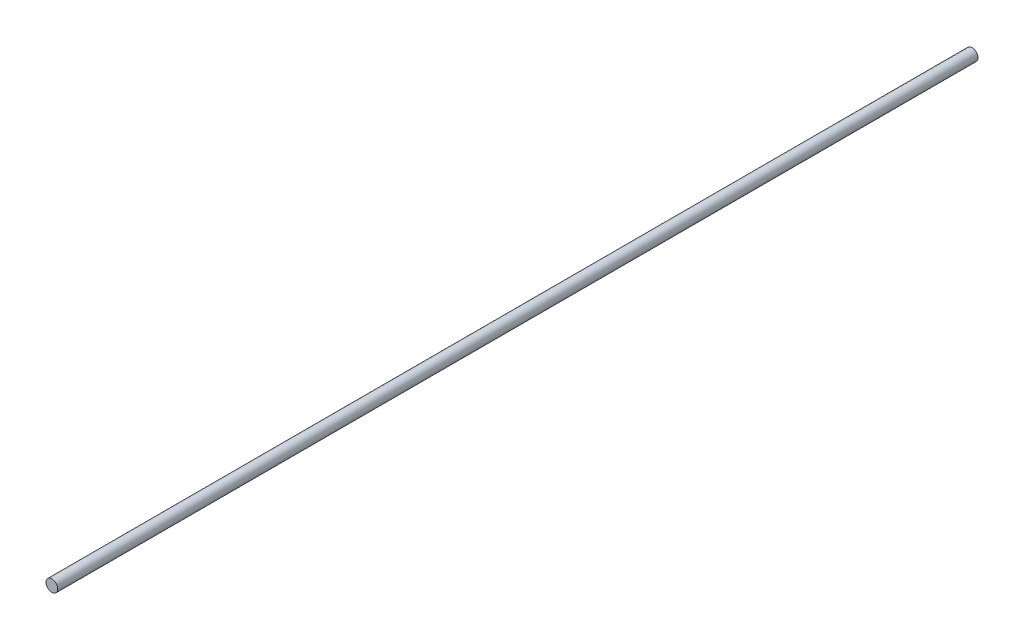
SolidWorks part; units mm, degrees
ref_plane "Front Plane" through (0, 0, 0) normal (0, 0, 1) x (1, 0, 0)
ref_plane "Top Plane" through (0, 0, 0) normal (0, 1, 0) x (1, 0, 0)
ref_plane "Right Plane" through (0, 0, 0) normal (1, 0, 0) x (0, 0, -1)
sketch "Sketch1" plane through (0, 0, 0) normal (0, 0, 1) x (1, 0, 0)
  circle A0 centre (0, 0) radius 30
  dimension "D1" = 60
extrude "Boss-Extrude1" add sketch "Sketch1" against normal blind 4700
